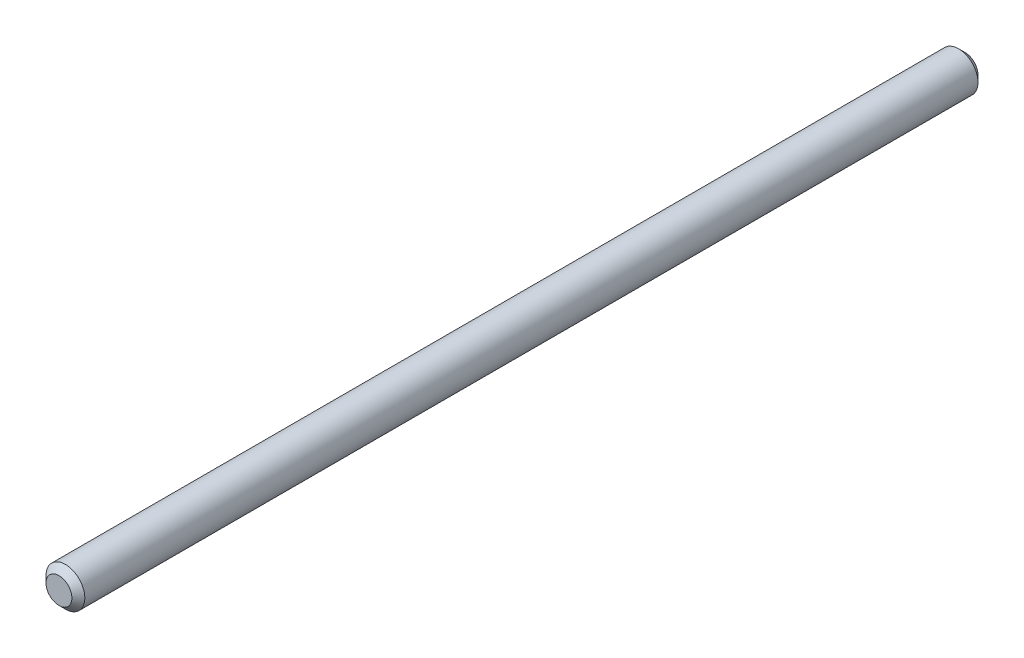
SolidWorks part; units mm, degrees
ref_plane "Plan1" through (0, 0, 0) normal (0, 0, 1) x (1, 0, 0)
ref_plane "Plan2" through (0, 0, 0) normal (0, 1, 0) x (1, 0, 0)
ref_plane "Plan3" through (0, 0, 0) normal (1, 0, 0) x (0, 0, -1)
sketch "Esquisse1" plane through (0, 0, 0) normal (0, 0, 1) x (1, 0, 0)
  circle A0 centre (0, 0) radius 1.5
  dimension "D1" = 3
extrude "Base-Extrusion" add sketch "Esquisse1" along normal blind 70
chamfer "Chanfrein1" distance 0.5 angle 45 2 edges at (1.5, 0, 0) (1.5, 0, 70)
